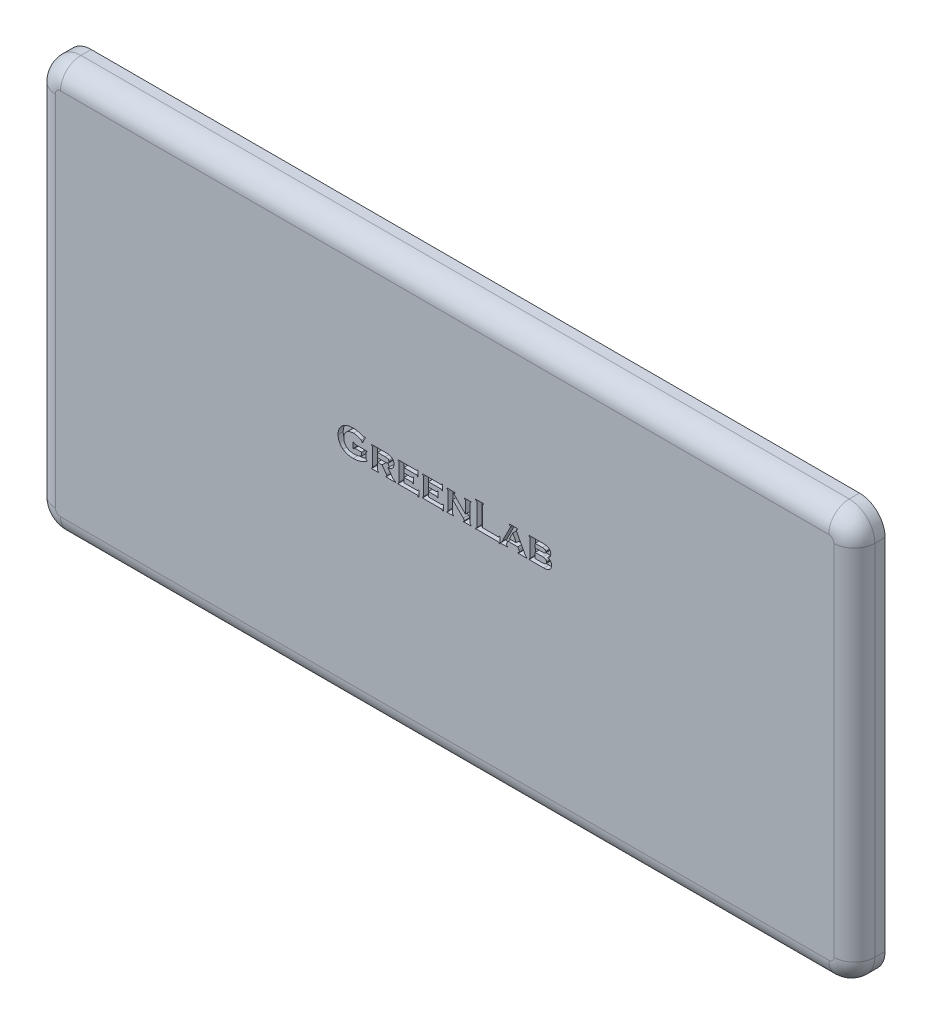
SolidWorks part; units mm, degrees
ref_plane "Front Plane" through (0, 0, 0) normal (0, 0, 1) x (1, 0, 0)
ref_plane "Top Plane" through (0, 0, 0) normal (0, 1, 0) x (1, 0, 0)
ref_plane "Right Plane" through (0, 0, 0) normal (1, 0, 0) x (0, 0, -1)
ref_plane "Plane1" through (0, 0, 3) normal (0, 0, 1) x (1, 0, 0)
sketch "Sketch1" plane through (0, 0, 3) normal (0, 0, 1) x (1, 0, 0)
  line L0 (57.5, -22.5) -> (57.5, 17.5)
  line L1 (57.5, 17.5) -> (-22.5, 17.5)
  line L2 (-22.5, 17.5) -> (-22.5, -22.5)
  line L3 (-22.5, -22.5) -> (57.5, -22.5)
  dimension "D1" = 80
  dimension "D2" = 40
extrude "Boss-Extrude1" add sketch "Sketch1" against normal blind 3
fillet "Fillet1" radius 2.5 4 edges at (-22.5, 17.5, 1.5) (57.5, 17.5, 1.5) (-22.5, -22.5, 1.5) (57.5, -22.5, 1.5)
fillet "Fillet2" radius 2 8 edges at (-21.7678, -21.7678, 3) (-22.5, -2.5, 3) (17.5, -22.5, 3) (-21.7678, 16.7678, 3) (56.7678, -21.7678, 3) (17.5, 17.5, 3) (57.5, -2.5, 3) (56.7678, 16.7678, 3)
sketch "Sketch2" plane through (0, 0, 3) normal (0, 0, 1) x (1, 0, 0)
  line L0 (-20.5, -1.25) -> (55.5, -1.25) construction
  line L1 (-20.5, 15) -> (-20.5, -20) construction
  line L2 (55.5, -20) -> (55.5, 15) construction
  line L3 (55, -22.5) -> (-20, -22.5) construction
  text T0 "GreenLab" font "Copperplate Gothic Bold" height 2.5
  dimension "D1" = 21.25
extrude "Cut-Extrude1" cut sketch "Sketch2" against normal blind 0.5
